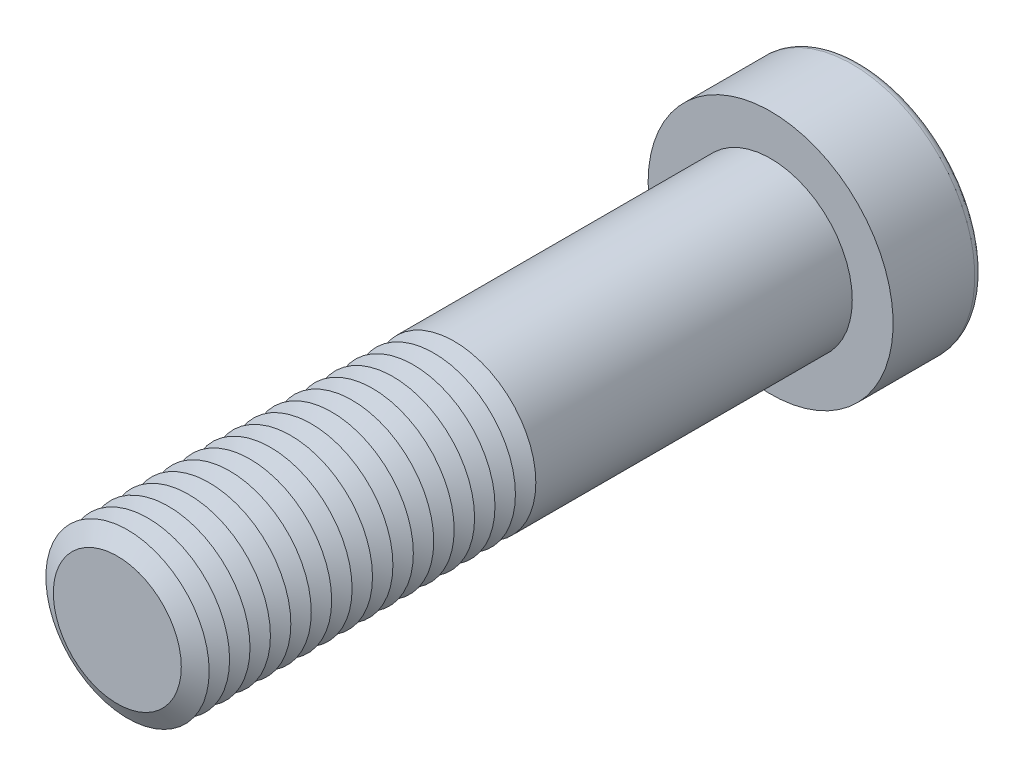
SolidWorks part; units mm, degrees
ref_plane "Front Plane" through (0, 0, 0) normal (0, 0, 1) x (1, 0, 0)
ref_plane "Top Plane" through (0, 0, 0) normal (0, 1, 0) x (1, 0, 0)
ref_plane "Right Plane" through (0, 0, 0) normal (1, 0, 0) x (0, 0, -1)
sketch "Sketch1" plane through (0, 0, 0) normal (0, 0, 1) x (1, 0, 0)
  circle A0 centre (0, 0) radius 10
  dimension "D1" = 20
extrude "Boss-Extrude1" add sketch "Sketch1" along normal blind 80
sketch "Sketch2" plane through (0, 0, 0) normal (0, 0, -1) x (-1, 0, 0)
  circle A0 centre (0, 0) radius 15
  dimension "D1" = 30
extrude "Boss-Extrude2" add sketch "Sketch2" along normal blind 11
sketch "Sketch3" plane through (0, 0, -11) normal (0, 0, -1) x (-1, 0, 0)
  line L1 (-4.0415, 7) -> (-8.0829, 0)
  line L2 (-8.0829, 0) -> (-4.0415, -7)
  line L3 (-4.0415, -7) -> (4.0415, -7)
  line L4 (4.0415, -7) -> (8.0829, 0)
  line L5 (8.0829, 0) -> (4.0415, 7)
  line L6 (4.0415, 7) -> (-4.0415, 7)
  circle A0 centre (0, 0) radius 7 construction
  dimension "D1" = 14
extrude "Cut-Extrude1" cut sketch "Sketch3" against normal blind 10.5
fillet "Fillet1" radius 1 1 edges at (-15, 0, -11)
sketch "Sketch4" plane through (0, 0, -0.5) normal (0, 0, -1) x (-1, 0, 0)
  line L0 (4.0415, -7) -> (8.0829, 0) construction
  circle A0 centre (0, 0) radius 7
extrude "Cut-Extrude2" cut sketch "Sketch4" against normal through all draft 60
sketch "Sketch5" plane through (0, 0, -11) normal (0, 0, -1) x (-1, 0, 0)
  circle A0 centre (0, 0) radius 8.0829
extrude "Cut-Extrude3" cut sketch "Sketch5" against normal through all draft 75
sketch "Sketch7" plane through (0, 0, 0) normal (1, 0, 0) x (0, 0, -1)
  line L25 (-80, 7.8349) -> (-78.75, 10)
  line L26 (-80, 10) -> (-80, -10) construction
  line L27 (-78.75, 10) -> (-81.25, 10)
  line L28 (-81.25, 10) -> (-80, 7.8349)
  line L29 (0, 10) -> (-80, 10) construction
  dimension "D1" = 2.5
revolve "Cut-Revolve1" cut sketch "Sketch7" angle 360 about axis through (0, 0, 80) along (0, 0, -1)
pattern_linear "LPattern1" count 17 spacing 2.5 along (0, 0, -1) of "Cut-Revolve1"
